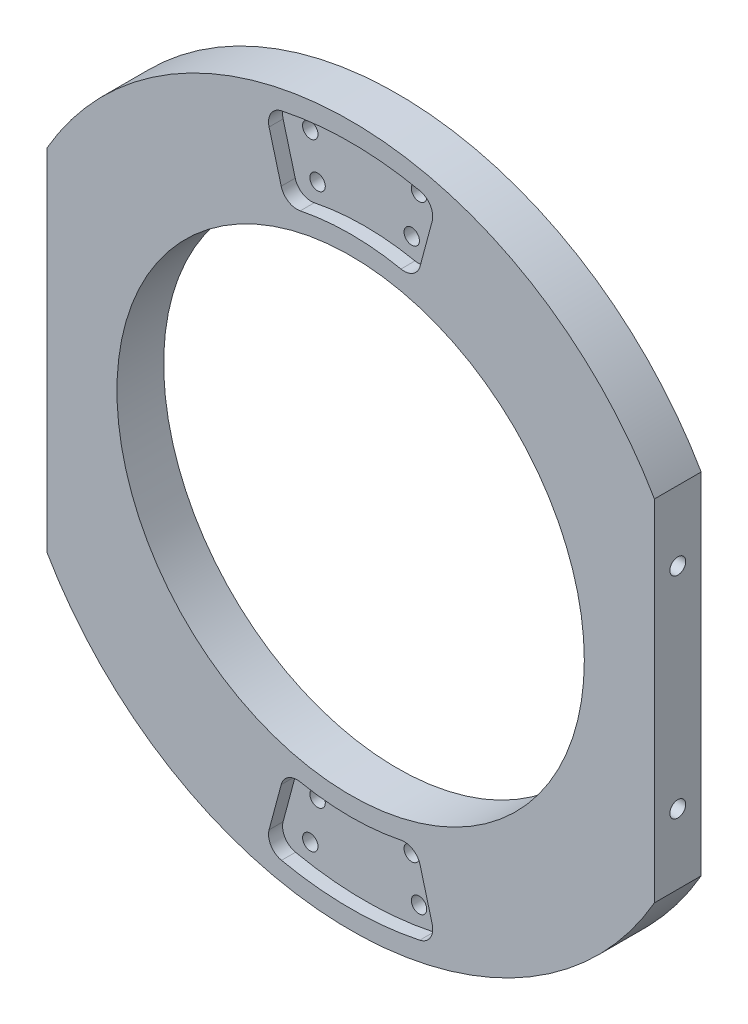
SolidWorks part; units mm, degrees
ref_plane "Front" through (0, 0, 0) normal (0, 0, 1) x (1, 0, 0)
ref_plane "Top" through (0, 0, 0) normal (0, 1, 0) x (1, 0, 0)
ref_plane "Right" through (0, 0, 0) normal (1, 0, 0) x (0, 0, -1)
sketch "Sketch1" plane through (0, 0, 0) normal (0, 0, 1) x (1, 0, 0)
  circle A0 centre (0, 0) radius 150
  circle A1 centre (0, 0) radius 100
  dimension "D1" = 300
  dimension "D2" = 200
extrude "Boss-Extrude1" add sketch "Sketch1" against normal blind 20
sketch "Sketch2" plane through (0, 0, 0) normal (0, 0, 1) x (1, 0, 0)
  line L0 (0, 0) -> (-27.9525, 104.32) construction
  line L1 (-27.9525, 104.32) -> (-36.7523, 137.1615)
  line L2 (0, 0) -> (27.9525, 104.32) construction
  line L3 (27.9525, 104.32) -> (36.7523, 137.1615)
  line L4 (0, 0) -> (0, 100) construction
  circle A0 centre (0, 0) radius 100 construction
  circle A2 centre (0, 0) radius 142
  arc A3 (36.7523, 137.1615) -> (-36.7523, 137.1615) centre (0, 0) ccw
  circle A5 centre (0, 0) radius 108
  arc A6 (27.9525, 104.32) -> (-27.9525, 104.32) centre (0, 0) ccw
  dimension "D3" = 30
  dimension "D1" = 8
  dimension "D2" = 8
extrude "Cut-Extrude1" cut sketch "Sketch2" against normal blind 6
fillet "Fillet1" radius 7 4 edges at (27.9525, 104.32, -3) (36.7523, 137.1615, -3) (-27.9525, 104.32, -3) (-36.7523, 137.1615, -3)
hole_wizard "CBORE for M6 Hex Socket Head Cap Screw1" positions "Sketch4" profile "Sketch3" counterbore size "M6" standard "ISO"
sketch "Sketch4" plane through (0, 0, -20) normal (0, 0, -1) x (-1, 0, 0)
  line L0 (0, 0) -> (-20.1432, 114.2377) construction
  line L1 (-20.1432, 114.2377) -> (-23.2689, 131.9642) construction
  line L4 (0, 0) -> (0, 100) construction
  line L7 (0, 0) -> (20.1432, 114.2377) construction
  line L8 (20.1432, 114.2377) -> (23.2689, 131.9642) construction
  circle A0 centre (0, 0) radius 134 construction
  circle A1 centre (0, 0) radius 116 construction
  circle A2 centre (0, 0) radius 100 construction
  point P0 (-20.1432, 114.2377)
  point P1 (23.2689, 131.9642)
  point P3 (20.1432, 114.2377)
  point P5 (-23.2689, 131.9642)
  dimension "D2" = 232
  dimension "D3" = 268
  dimension "D1" = 20
sketch "Sketch3" plane through (20.1432, 114.2377, -20) normal (1, 0, 0) x (0, 1, 0)
  line L0 (0, 0) -> (0, 20)
  line L1 (0, 20) -> (3.3, 20)
  line L3 (3.3, 20) -> (3.3, 6.4)
  line L4 (5.5, 6.4) -> (3.3, 6.4)
  line L5 (5.5, 6.4) -> (5.5, 0.5)
  line L6 (5.5, 0.5) -> (6, 0)
  line L7 (6, 0) -> (0, 0)
  line L8 (-5.5, 0.5) -> (-6, 0) construction
  line L11 (0, -6.35) -> (0, 107.95) construction
  dimension "Thru Hole Dia." = 6.6
  dimension "Thru Hole Depth" = 20
  dimension "C'Bore Dia." = 11
  dimension "C'Bore Depth" = 6.4
  dimension "Near C'Sink Dia." = 12
  dimension "Near C'Sink Angle" = 90
mirror "Mirror1" about plane through (0, 0, 0) normal (0, 1, 0) of "CBORE for M6 Hex Socket Head Cap Screw1", "Fillet1", "Cut-Extrude1"
sketch "Sketch5" plane through (0, 0, 0) normal (0, 0, 1) x (1, 0, 0)
  line L1 (130, -150) -> (-130, -150)
  line L2 (130, -150) -> (130, 150)
  line L3 (130, 150) -> (-130, 150)
  line L4 (-130, -150) -> (-130, 150)
  line L5 (130, -150) -> (-130, 150) construction
  line L6 (130, 150) -> (-130, -150) construction
  circle A1 centre (0, 0) radius 150 construction
  circle A2 centre (0, 0) radius 130
  circle A3 centre (0, 0) radius 130 construction
  point P0 (0, 0)
  dimension "D1" = 20
extrude "Cut-Extrude2" cut sketch "Sketch5" against normal through all flip side to cut
hole_wizard "M8 Tapped Hole1" positions "Sketch7" profile "Sketch6" tap size "M8" standard "ISO"
sketch "Sketch7" plane through (130, 0, 0) normal (1, 0, 0) x (0, 0, -1)
  line L0 (10, -74.8331) -> (10, -45) construction
  line L1 (20, -74.8331) -> (0, -74.8331) construction
  line L2 (10, -45) -> (10, 45) construction
  line L3 (10, 45) -> (10, 74.8331) construction
  line L4 (0, 74.8331) -> (20, 74.8331) construction
  point P0 (10, 45)
  point P1 (10, -45)
  dimension "D1" = 90
sketch "Sketch6" plane through (130, 45, -10) normal (0, 1, 0) x (0, 0, -1)
  line L0 (0, 0) -> (0, 24.2929)
  line L1 (0, 24.2929) -> (3.4, 22.25)
  line L2 (3.4, 22.25) -> (3.4, 0)
  line L5 (3.4, 0) -> (0, 0)
  line L10 (0, 24.2929) -> (-3.4, 22.25) construction
  line L11 (0, -6.35) -> (0, 107.95) construction
  dimension "Tap Drill Dia." = 6.8
  dimension "Tap Drill Depth" = 22.25
  dimension "Drill Angle" = 118
mirror "Mirror2" about plane through (0, 0, 0) normal (1, 0, 0) of "M8 Tapped Hole1"
